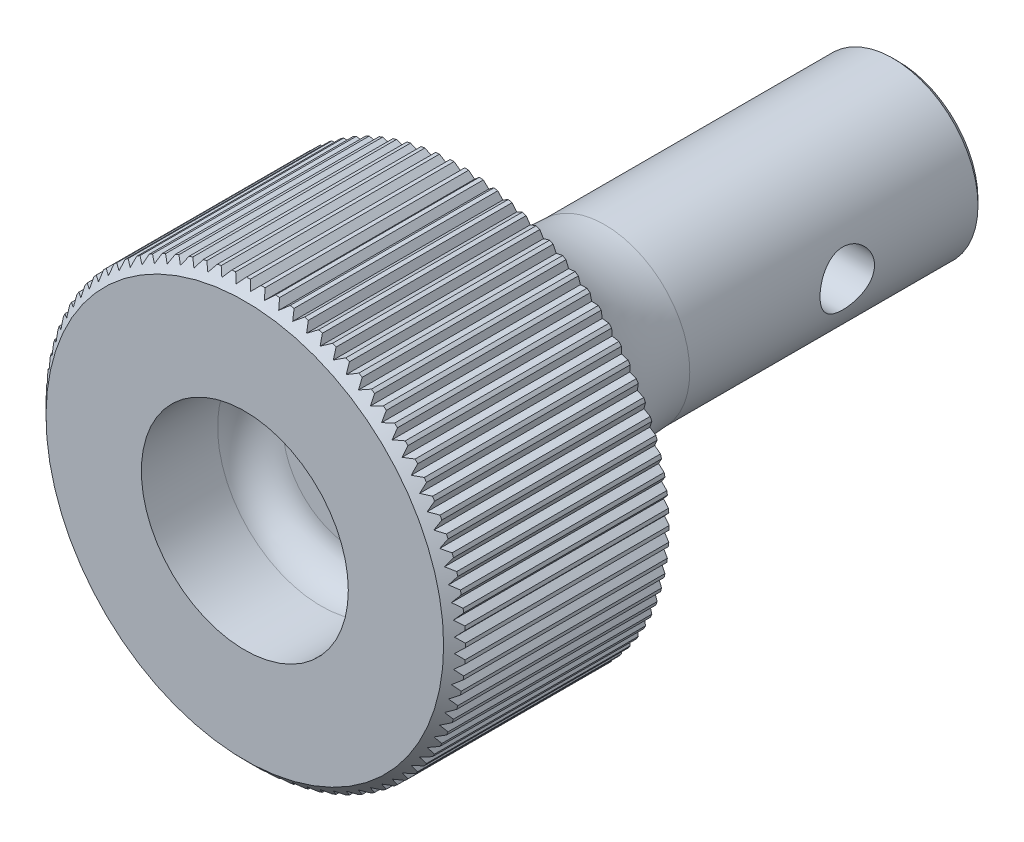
SolidWorks part; units mm, degrees
ref_plane "Front Plane" through (0, 0, 0) normal (0, 0, 1) x (1, 0, 0)
ref_plane "Top Plane" through (0, 0, 0) normal (0, 1, 0) x (1, 0, 0)
ref_plane "Right Plane" through (0, 0, 0) normal (1, 0, 0) x (0, 0, -1)
sketch "Sketch1" plane through (0, 0, 0) normal (1, 0, 0) x (0, 0, -1)
  line L0 (0, -13.1345) -> (0, 0) construction
  line L1 (0, 0) -> (15.24, 0) construction
  line L2 (0, -2.413) -> (0, -4.6355)
  line L3 (0.254, -4.8895) -> (5.0038, -4.8895)
  line L5 (8.393, -1.9812) -> (15.113, -1.9812)
  line L6 (15.24, -1.8542) -> (15.24, -1.143)
  line L7 (15.24, -1.143) -> (12.954, -1.143)
  line L8 (12.954, -1.143) -> (12.954, -0.889)
  line L9 (12.954, -0.889) -> (5.334, -0.889)
  line L10 (5.334, -0.889) -> (5.334, -1.143)
  line L11 (5.334, -1.143) -> (2.54, -1.143)
  line L12 (2.54, -1.143) -> (2.54, -1.651)
  line L13 (1.778, -2.413) -> (0, -2.413)
  line L14 (0, -4.6355) -> (0.254, -4.8895)
  line L15 (15.113, -1.9812) -> (15.24, -1.8542)
  arc A0 (5.0038, -4.8895) -> (8.393, -1.9812) centre (8.393, -5.4102) cw
  arc A1 (2.54, -1.651) -> (1.778, -2.413) centre (1.778, -1.651) cw
  point P5 (0, -4.8895)
  point P8 (15.24, -1.9812)
  point P12 (5.334, -1.016)
  point P17 (3.937, -1.143)
  dimension "D12" = 3.429
  dimension "D13" = 0.762
  dimension "D1" = 15.24
  dimension "D2" = 5.0038
  dimension "D3" = 2.54
  dimension "D4" = 5.334
  dimension "D5" = 2.286
  dimension "D6" = 9.779
  dimension "D7" = 2.286
  dimension "D8" = 4.826
  dimension "D9" = 1.778
  dimension "D10" = 2.286
  dimension "D11" = 3.9624
revolve "Revolve1" add sketch "Sketch1" angle 360 about L1
thread "Thread1" pitch 0.4536 start angle 0, offset 1.524, length 10, pitch 0.4536, diameter 1.778
ref_plane "Plane1" through (-0.889, 0, -3.81) normal (0, -1, 0) x (-1, 0, 0)
sketch "Thread Profile1" plane through (-0.889, 0, -3.81) normal (0, -1, 0) x (-1, 0, 0)
  line L0 (0, 0) -> (0, 0.4536) construction
  line L1 (0, 0) -> (0.2455, 0.1417)
  line L2 (0.2455, 0.1417) -> (0.2455, 0.1984)
  line L3 (0.2455, 0.1984) -> (0, 0.3402)
  line L4 (0.2455, 0.1701) -> (0, 0.1701) construction
  line L11 (0, 0) -> (0, 0.3402)
  point P2 (0, 0)
  dimension "Pitch" = 0.4536
  dimension "Profile_Angle" = 60
  dimension "Profile_Land" = 0.0567
  dimension "Profile_Height" = 0.2455
sketch "Sketch4" plane through (0, 0, 0) normal (0, 0, 1) x (1, 0, 0)
  line L0 (0, 0) -> (0, 4.8895) construction
  line L1 (0.127, 4.8895) -> (-0.127, 4.8895)
  line L2 (-0.127, 4.8895) -> (0, 4.7625)
  line L3 (0.127, 4.8895) -> (0, 4.7625)
  circle A0 centre (0, 0) radius 4.8895 construction
  dimension "D1" = 90
  dimension "D2" = 0.254
extrude "Cut-Extrude1" cut sketch "Sketch4" against normal blind 5.08
pattern_circular "CirPattern1" count 90 over 360 about axis through (0, 0, 0) along (0, 0, 1) of "Cut-Extrude1"
sketch "Sketch5" plane through (0, 0, 0) normal (1, 0, 0) x (0, 0, -1)
  line L0 (18.3491, 0) -> (12.065, 0) construction
  line L2 (15.24, -1.8542) -> (15.24, 1.8542) construction
  circle A0 centre (12.065, 0) radius 0.635
  point P3 (15.2071, 0)
  dimension "D1" = 1.27
  dimension "D2" = 3.175
extrude "Cut-Extrude2" cut sketch "Sketch5" against normal through all both and the other way through all
